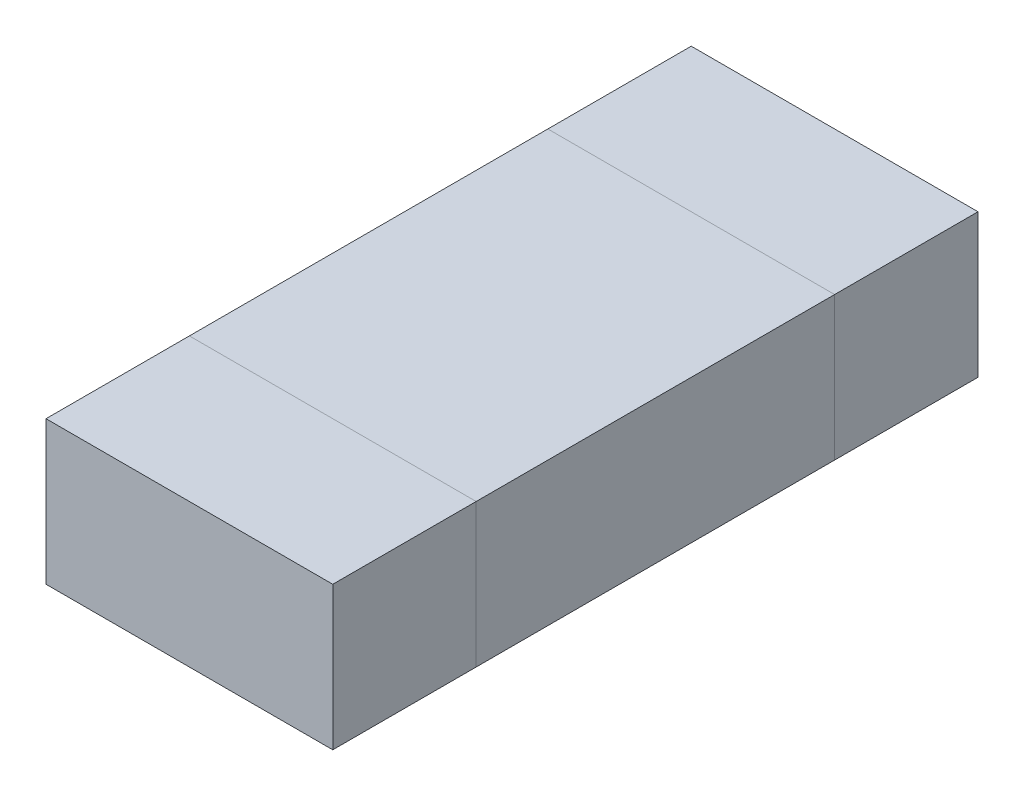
SolidWorks part; units mm, degrees
ref_plane "Front Plane" through (0, 0, 0) normal (0, 0, 1) x (1, 0, 0)
ref_plane "Top Plane" through (0, 0, 0) normal (0, 1, 0) x (1, 0, 0)
ref_plane "Right Plane" through (0, 0, 0) normal (1, 0, 0) x (0, 0, -1)
sketch "MainBodyS" plane through (0, 0, 0) normal (0, 1, 0) x (1, 0, 0)
  line L1 (-0.4, 0.5) -> (0.4, 0.5)
  line L2 (-0.4, 0.5) -> (-0.4, -0.5)
  line L3 (-0.4, -0.5) -> (0.4, -0.5)
  line L4 (0.4, 0.5) -> (0.4, -0.5)
  line L5 (-0.4, 0.5) -> (0.4, -0.5) construction
  line L6 (-0.4, -0.5) -> (0.4, 0.5) construction
  point P0 (0, 0)
  dimension "Length" = 1
  dimension "Width" = 0.8
extrude "MainBody" add sketch "MainBodyS" along normal blind 0.4
sketch "LeftBodyS" plane through (0, 0, 0) normal (0, -1, 0) x (-1, 0, 0)
  line L1 (0.4, -0.5) -> (-0.4, -0.5)
  line L2 (0.4, -0.5) -> (0.4, -0.9)
  line L3 (0.4, -0.9) -> (-0.4, -0.9)
  line L4 (-0.4, -0.5) -> (-0.4, -0.9)
  dimension "Width" = 0.4
extrude "Boss-Extrude1" add sketch "LeftBodyS" against normal up to surface (0.4 mm away) separate body
sketch "RightBodyS" plane through (0, 0, 0) normal (0, -1, 0) x (1, 0, 0)
  line L0 (0.4, 0.5) -> (0.4, 0.9) construction
  line L1 (-0.4, -0.5) -> (0.4, -0.5)
  line L2 (-0.4, -0.5) -> (-0.4, -0.9)
  line L3 (-0.4, -0.9) -> (0.4, -0.9)
  line L4 (0.4, -0.5) -> (0.4, -0.9)
extrude "Boss-Extrude2" add sketch "RightBodyS" against normal up to surface (0.4 mm away) separate body
